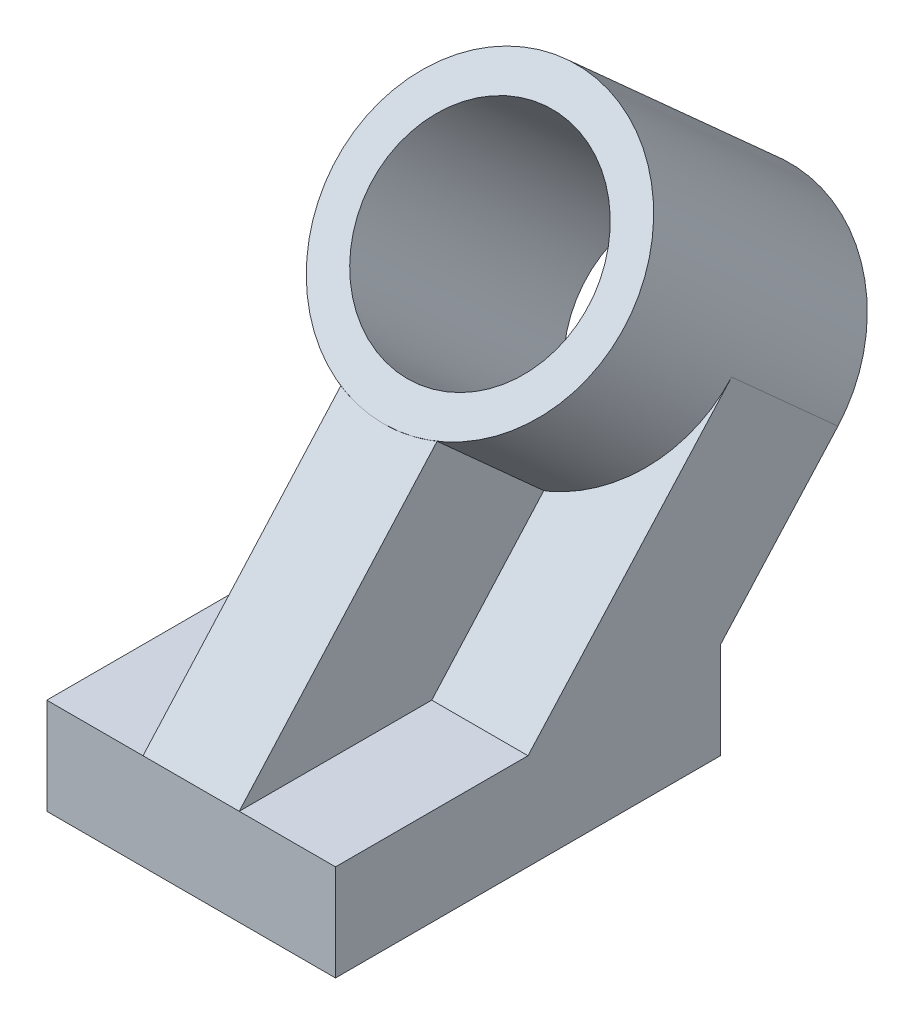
SolidWorks part; units mm, degrees
ref_plane "Front Plane" through (0, 0, 0) normal (0, 0, 1) x (1, 0, 0)
ref_plane "Top Plane" through (0, 0, 0) normal (0, 1, 0) x (1, 0, 0)
ref_plane "Right Plane" through (0, 0, 0) normal (1, 0, 0) x (0, 0, -1)
sketch "Sketch1" plane through (0, 0, 0) normal (1, 0, 0) x (0, 0, -1)
  line L0 (-50.8, 0) -> (50.8, 0)
  line L1 (-50.8, 0) -> (-50.8, 25.4)
  line L2 (50.8, 0) -> (50.8, 25.4)
  line L3 (-50.8, 25.4) -> (0, 25.4)
  line L4 (50.8, 25.4) -> (107.2856, 88.1336)
  line L5 (0, 25.4) -> (79.2305, 113.3944)
  line L6 (107.2856, 88.1336) -> (79.2305, 113.3944)
  dimension "D1" = 101.6
  dimension "D2" = 25.4
  dimension "D3" = 48
  dimension "D4" = 50.8
  dimension "D5" = 152.4
extrude "Boss-Extrude1" add sketch "Sketch1" along normal mid plane 76.2
ref_plane "Plane4" through (0, 11.3725, 12.6304) normal (0, 0.6691, 0.7431) x (1, 0, 0)
sketch "Sketch6" plane through (0, 11.3725, 12.6304) normal (0, 0.6691, 0.7431) x (1, 0, 0)
  line L1 (0, -33.9918) -> (0, 137.284) construction
  line L2 (38.1, -33.9918) -> (-38.1, -33.9918) construction
  line L4 (38.1, -15.116) -> (-38.1, -15.116) construction
  line L5 (38.1, 99.184) -> (38.1, 137.284)
  line L6 (-38.1, 99.184) -> (-38.1, 137.284)
  line L7 (38.1, 137.284) -> (-38.1, 137.284)
  arc A0 (38.1, 99.184) -> (-38.1, 99.184) centre (0, 99.184) ccw
  dimension "D2" = 76.2
  dimension "D1" = 114.3
  dimension "D3" = 76.2
  dimension "D4" = 152.4
extrude "Cut-Extrude5" cut sketch "Sketch6" against normal blind 38.1 contours A0 L7 L6 | A0 L5 L7
ref_plane "Plane5" through (0, 11.3725, 12.6304) normal (0, 0.6691, 0.7431) x (1, 0, 0)
sketch "Sketch7" plane through (0, 11.3725, 12.6304) normal (0, 0.6691, 0.7431) x (1, 0, 0)
  line L0 (0, -33.9918) -> (0, 137.284) construction
  line L1 (38.1, -33.9918) -> (-38.1, -33.9918) construction
  line L2 (38.1, -15.116) -> (-38.1, -15.116) construction
  arc A0 (38.1, 99.184) -> (-38.1, 99.184) centre (0, 99.184) ccw construction
  circle A1 centre (0, 99.184) radius 38.1
  dimension "D1" = 114.3
  dimension "D2" = 76.2
extrude "Boss-Extrude2" add sketch "Sketch7" along normal blind 38.1
ref_plane "Plane6" through (0, 36.8664, 40.9442) normal (0, 0.6691, 0.7431) x (1, 0, 0)
sketch "Sketch8" plane through (0, 36.8664, 40.9442) normal (0, 0.6691, 0.7431) x (1, 0, 0)
  line L0 (-38.1, 99.184) -> (38.1, 99.184) construction
  line L1 (0, 137.284) -> (0, 61.084) construction
  circle A0 centre (0, 99.184) radius 38.1 construction
  arc A1 (-38.1, 99.184) -> (38.1, 99.184) centre (0, 99.184) ccw construction
  circle A2 centre (0, 99.184) radius 28.575
  dimension "D1" = 57.15
extrude "Cut-Extrude6" cut sketch "Sketch8" against normal up to next
sketch "Sketch11" plane through (0, 0, 0) normal (1, 0, 0) x (0, 0, -1)
  line L0 (6.3024, 89.3391) -> (-50.8, 25.4)
  line L1 (-50.8, 25.4) -> (0, 25.4)
  line L2 (0, 25.4) -> (34.4601, 63.9859)
  line L3 (34.4601, 63.9859) -> (6.3024, 89.3391)
  dimension "D1" = 85.725
extrude "Boss-Extrude4" add sketch "Sketch11" along normal mid plane 25.4
